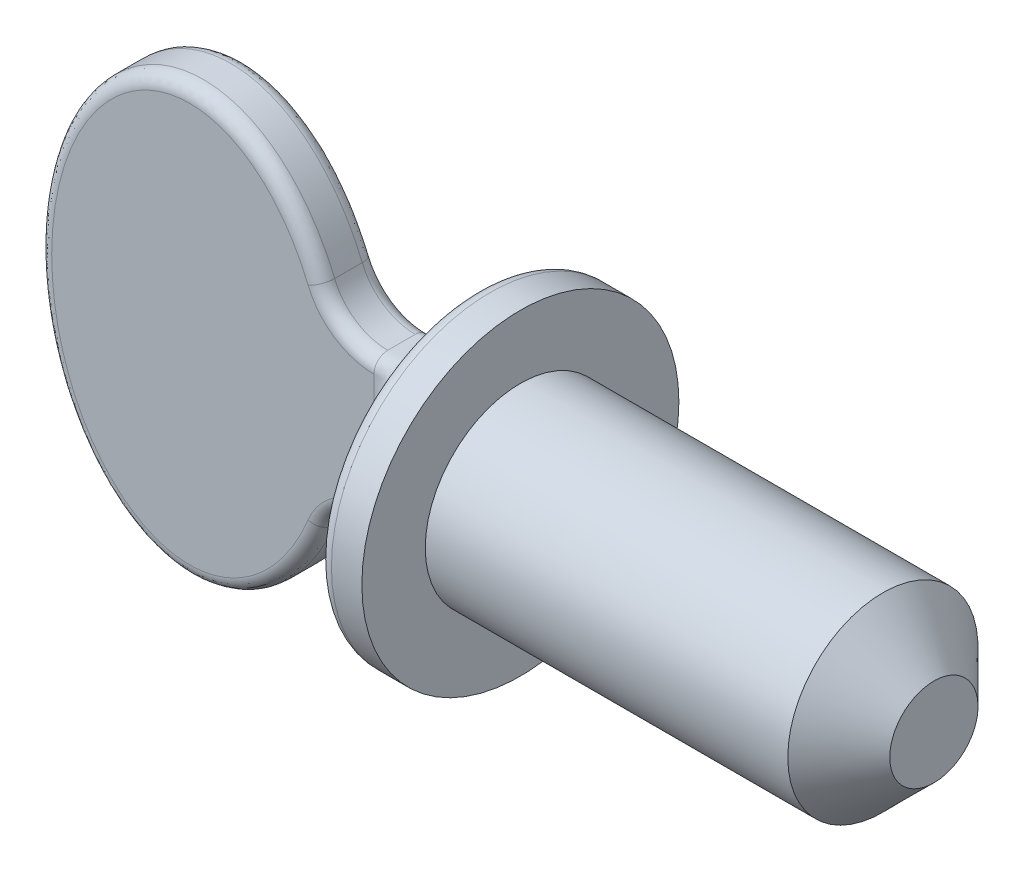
SolidWorks part; units mm, degrees
ref_plane "Front Plane" through (0, 0, 0) normal (0, 0, 1) x (1, 0, 0)
ref_plane "Top Plane" through (0, 0, 0) normal (0, 1, 0) x (1, 0, 0)
ref_plane "Right Plane" through (0, 0, 0) normal (1, 0, 0) x (0, 0, -1)
other "Configuration Table"
sketch "layout" plane through (0, 0, 0) normal (0, 0, 1) x (1, 0, 0)
  line L0 (0, 0) -> (13.208, 0) construction
  line L1 (5.588, 2.921) -> (5.588, -2.921)
  line L2 (3.3976, 1.3123) -> (4.8921, 1.3123) construction
  line L3 (5.588, 2.921) -> (4.7897, 2.921)
  line L4 (4.7897, 2.921) -> (4.7897, 3.2655) construction
  line L5 (4.2865, 1.706) -> (4.2865, 0)
  line L6 (4.2865, 1.706) -> (3.3355, 0.7551) construction
  line L7 (13.208, 1.7526) -> (13.208, 0)
  line L8 (3.3976, 1.3123) -> (3.3976, -1.3123)
  line L9 (13.208, 1.7526) -> (5.588, 1.7526)
  arc A0 (3.3976, 1.3123) -> (2.4197, 1.9685) centre (3.3976, 2.3692) cw
  arc A1 (4.7897, 2.921) -> (4.2865, 1.706) centre (3.0715, 2.921) cw
  arc A2 (3.3976, -1.3123) -> (2.4197, -1.9685) centre (3.3976, -2.3692) ccw
  ellipse E0 centre (0, 0) end of major axis (0, 3.937) minor radius 2.794 (2.4197, 1.9685) -> (2.4197, -1.9685) ccw
sketch "Sketch3" plane through (0, 0, 0) normal (0, 0, 1) x (1, 0, 0)
  line L0 (3.3976, 1.3123) -> (3.3976, -1.3123) construction
  line L1 (3.3976, 1.3123) -> (3.3976, -1.3123)
  arc A0 (3.3976, -1.3123) -> (2.4197, -1.9685) centre (3.3976, -2.3692) ccw construction
  arc A1 (2.4197, 1.9685) -> (3.3976, 1.3123) centre (3.3976, 2.3692) ccw construction
  arc A2 (3.3976, -1.3123) -> (2.4197, -1.9685) centre (3.3976, -2.3692) ccw
  arc A3 (2.4197, 1.9685) -> (3.3976, 1.3123) centre (3.3976, 2.3692) ccw
  ellipse E0 centre (0, 0) end of major axis (0, 3.937) minor radius 2.794 (2.4197, 1.9685) -> (2.4197, -1.9685) ccw construction
  ellipse E1 centre (0, 0) end of major axis (0, 3.937) minor radius 2.794 (2.4197, 1.9685) -> (2.4197, -1.9685) ccw
extrude "Extrude1" add sketch "Sketch3" along normal mid plane 1.016
fillet "Fillet1" radius 0.254 6 edges at (2.8088, 1.4916, -0.508) (2.8088, -1.4916, -0.508) (2.8088, 1.4916, 0.508) (2.8088, -1.4916, 0.508) (-2.794, 0, -0.508) (-2.794, 0, 0.508)
sketch "Sketch4" plane through (0, 0, 0) normal (0, 0, 1) x (1, 0, 0)
  line L0 (13.208, 1.7526) -> (13.208, 0) construction
  line L1 (13.208, 1.7526) -> (5.588, 1.7526) construction
  line L2 (5.588, 2.921) -> (5.588, -2.921) construction
  line L3 (5.588, 2.921) -> (4.7897, 2.921) construction
  line L4 (4.2865, 1.706) -> (4.2865, 0) construction
  line L5 (13.208, 0.8128) -> (13.208, 0)
  line L6 (12.2682, 1.7526) -> (5.588, 1.7526)
  line L7 (5.588, 2.921) -> (5.588, 1.7526)
  line L8 (5.588, 2.921) -> (4.7897, 2.921)
  line L9 (4.2865, 1.706) -> (4.2865, 0)
  line L10 (0, 0) -> (16.8942, 0) construction
  line L11 (13.208, 0) -> (4.2865, 0)
  line L12 (12.2682, 1.7526) -> (13.208, 0.8128)
  line L15 (12.2682, -1.7526) -> (13.208, -0.8128) construction
  arc A0 (4.2865, 1.706) -> (4.7897, 2.921) centre (3.0715, 2.921) ccw construction
  arc A1 (4.2865, 1.706) -> (4.7897, 2.921) centre (3.0715, 2.921) ccw
revolve "Revolve1" add sketch "Sketch4" angle 360 about L10
loft "Loft1" add
fillet "Fillet2" radius 0.254 1 edges at (4.7897, 0, 2.921)
sketch "Sketch5" plane through (0, 0, 0) normal (0, 1, 0) x (1, 0, 0)
  line L0 (11.7227, 2.2981) -> (12.2682, 2.2981)
  line L1 (12.2682, 2.2981) -> (12.2682, 1.7526)
  line L2 (12.2682, 1.7526) -> (11.9954, 1.2802)
  line L3 (11.9954, 1.2802) -> (11.7227, 1.7526)
  line L5 (11.7227, 1.7526) -> (11.7227, 2.2981)
  line L7 (-3.6147, 0) -> (14.1406, 0) construction
revolve "Cut-Revolve10" [suppressed] cut sketch "Sketch5" angle 360 about L7
pattern_linear "LPattern10" [suppressed] count 8 along (1, 0, 0)
equation "\"D4@layout\" = \"Head Height@layout\" / 3 * 2"
equation "\"D5@layout\" = \"Head Width@layout\" / 3"
equation "\"D6@layout\" = \"Head Width@layout\" / 2"
equation "\"D7@layout\" = \"D5@layout\" * 1.3"
equation "\"D8@layout\" = \"D4@layout\"  / 7"
equation "\"D1@Fillet1\" = \"Head Thickness@Extrude1\" / 4"
equation "\"D1@Fillet2\" = \"D1@Fillet1\""
equation "\"D1@Sketch5\" = ( \"Base Screw Dia@layout\"- \"Minor Dia@Cosmetic Thread1\" )  / 2"
equation "\"D1@LPattern10\" = int((\"Length@layout\"-\"O@Sketch4\"/2)/\"Advance@LPattern10\")"
